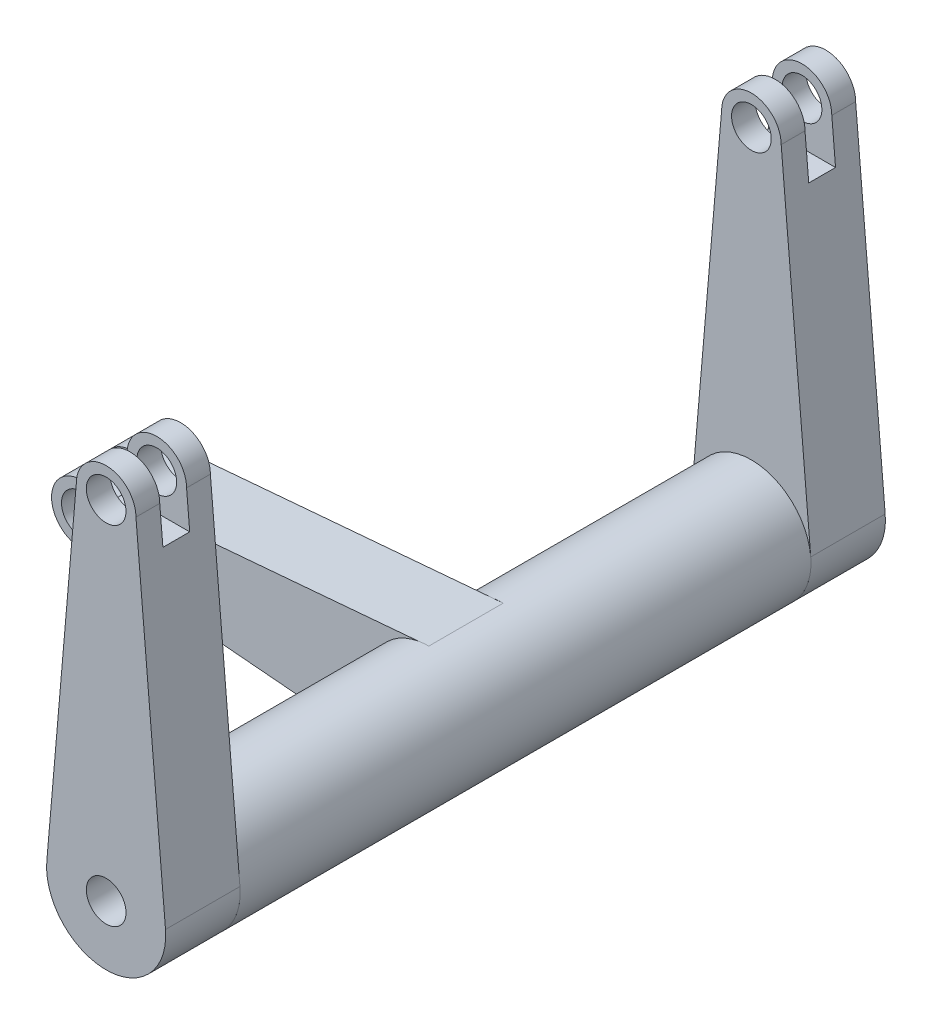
SolidWorks part; units mm, degrees
ref_plane "Front Plane" through (0, 0, 0) normal (0, 0, 1) x (1, 0, 0)
ref_plane "Top Plane" through (0, 0, 0) normal (0, 1, 0) x (1, 0, 0)
ref_plane "Right Plane" through (0, 0, 0) normal (1, 0, 0) x (0, 0, -1)
sketch "Sketch1" plane through (0, 0, 0) normal (0, 0, 1) x (1, 0, 0)
  line L0 (0, -170.9398) -> (88.9, -170.9398) construction
  line L1 (88.9, -155.6998) -> (88.9, -186.1798) construction
  line L2 (0, -163.3198) -> (88.9, -155.6998)
  line L3 (0, -178.5598) -> (88.9, -186.1798)
  circle A0 centre (0, -170.9398) radius 5.08
  arc A1 (0, -163.3198) -> (0, -178.5598) centre (0, -170.9398) ccw
  arc A2 (88.9, -186.1798) -> (88.9, -155.6998) centre (88.9, -170.9398) ccw
  dimension "D2" = 15.24
  dimension "D3" = 10.16
  dimension "D4" = 88.9
  dimension "D1" = 15.24
extrude "Extrude1" add sketch "Sketch1" along normal mid plane 19.05
sketch "Sketch3" plane through (0, 0, 0) normal (1, 0, 0) x (0, 0, -1)
  line L0 (0, -183.4572) -> (0, -158.0572) construction
  line L1 (3.429, -158.0572) -> (-3.429, -158.0572)
  line L2 (-3.429, -158.0572) -> (-3.429, -183.4572)
  line L3 (-3.429, -183.4572) -> (3.429, -183.4572)
  line L4 (3.429, -183.4572) -> (3.429, -158.0572)
  dimension "D1" = 6.858
  dimension "D2" = 25.4
extrude "Cut-Extrude1" cut sketch "Sketch3" against normal blind 19.05 and the other way blind 6.35
sketch "Sketch4" plane through (0, 0, 9.525) normal (0, 0, 1) x (1, 0, 0)
  circle A0 centre (88.9, -170.9398) radius 15.24
  dimension "D1" = 30.48
extrude "Extrude2" add sketch "Sketch4" along normal blind 63.5
sketch "Sketch5" plane through (0, 0, -9.525) normal (0, 0, -1) x (-1, 0, 0)
  circle A0 centre (-88.9, -170.9398) radius 15.24
  dimension "D1" = 30.48
extrude "Extrude3" add sketch "Sketch5" along normal blind 63.5
sketch "Sketch6" plane through (0, 0, 0) normal (0, 0, 1) x (1, 0, 0)
  line L0 (81.28, -82.0398) -> (73.7167, -169.6287)
  line L1 (96.52, -82.0398) -> (104.0833, -169.6287)
  arc A0 (73.7167, -169.6287) -> (104.0833, -169.6287) centre (88.9, -170.9398) ccw
  arc A1 (96.52, -82.0398) -> (81.28, -82.0398) centre (88.9, -82.0398) ccw
sketch "Sketch7" plane through (0, 0, 73.025) normal (0, 0, 1) x (1, 0, 0)
  line L2 (81.28, -82.0398) -> (73.7167, -169.6287)
  line L3 (104.0833, -169.6287) -> (96.52, -82.0398)
  line L4 (81.28, -82.0398) -> (73.7167, -169.6287)
  line L5 (104.0833, -169.6287) -> (96.52, -82.0398)
  arc A2 (73.7167, -169.6287) -> (104.0833, -169.6287) centre (88.9, -170.9398) ccw
  arc A3 (96.52, -82.0398) -> (81.28, -82.0398) centre (88.9, -82.0398) ccw
  arc A4 (73.7167, -169.6287) -> (104.0833, -169.6287) centre (88.9, -170.9398) ccw
  arc A5 (96.52, -82.0398) -> (81.28, -82.0398) centre (88.9, -82.0398) ccw
  dimension "D1" = 0
extrude "Extrude4" add sketch "Sketch7" along normal blind 19.05
sketch "Sketch8" plane through (0, 0, -73.025) normal (0, 0, -1) x (-1, 0, 0)
  line L2 (-73.7167, -169.6287) -> (-81.28, -82.0398)
  line L3 (-96.52, -82.0398) -> (-104.0833, -169.6287)
  line L4 (-73.7167, -169.6287) -> (-81.28, -82.0398)
  line L5 (-96.52, -82.0398) -> (-104.0833, -169.6287)
  arc A2 (-104.0833, -169.6287) -> (-73.7167, -169.6287) centre (-88.9, -170.9398) ccw
  arc A3 (-81.28, -82.0398) -> (-96.52, -82.0398) centre (-88.9, -82.0398) ccw
  arc A4 (-104.0833, -169.6287) -> (-73.7167, -169.6287) centre (-88.9, -170.9398) ccw
  arc A5 (-81.28, -82.0398) -> (-96.52, -82.0398) centre (-88.9, -82.0398) ccw
  dimension "D1" = 0
extrude "Extrude5" add sketch "Sketch8" along normal blind 19.05
sketch "Sketch9" plane through (0, 0, -92.075) normal (0, 0, -1) x (-1, 0, 0)
  circle A0 centre (-88.9, -82.0398) radius 5.08
  dimension "D1" = 10.16
extrude "Extrude6" cut sketch "Sketch9" against normal through all
sketch "Sketch10" plane through (0, 0, -92.075) normal (0, 0, -1) x (-1, 0, 0)
  circle A0 centre (-88.9, -170.9398) radius 5.08
  dimension "D1" = 10.16
extrude "Extrude7" cut sketch "Sketch10" against normal through all
sketch "Sketch11" plane through (0, 0, 0) normal (1, 0, 0) x (0, 0, -1)
  line L0 (-82.55, -55.3362) -> (-82.55, -113.9638) construction
  line L1 (-85.979, -65.976) -> (-79.121, -65.976)
  line L2 (-85.979, -65.976) -> (-85.979, -91.376)
  line L3 (-85.979, -91.376) -> (-79.121, -91.376)
  line L4 (-79.121, -65.976) -> (-79.121, -91.376)
  line L5 (79.121, -67.7069) -> (85.979, -67.7069)
  line L6 (79.121, -67.7069) -> (79.121, -93.1069)
  line L7 (79.121, -93.1069) -> (85.979, -93.1069)
  line L8 (85.979, -67.7069) -> (85.979, -93.1069)
  line L9 (-82.55, -82.0398) -> (-82.55, -40.1359) construction
  line L10 (-92.075, -82.0398) -> (-73.025, -82.0398) construction
  line L11 (82.55, -74.4198) -> (82.55, -42.673) construction
  line L13 (92.075, -74.4198) -> (73.025, -74.4198) construction
  dimension "D1" = 6.858
  dimension "D2" = 6.858
  dimension "D3" = 25.4
  dimension "D4" = 25.4
extrude "Extrude9" cut sketch "Sketch11" along normal through all
